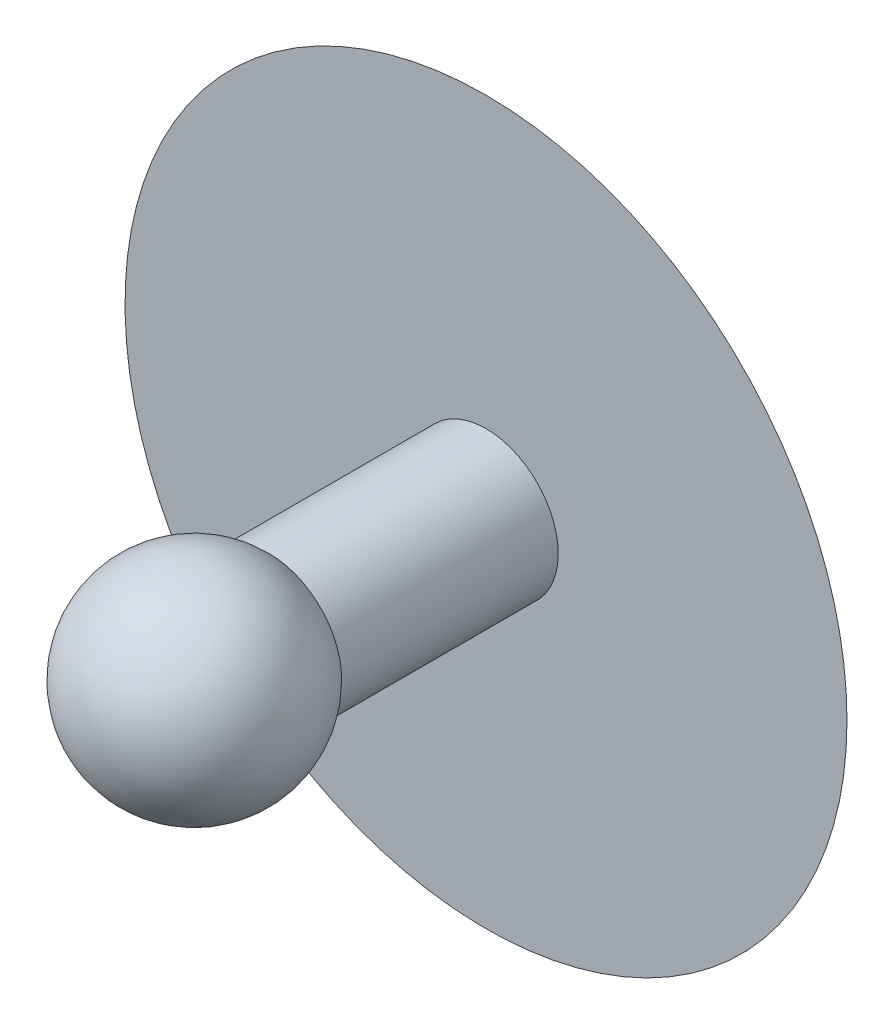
SolidWorks part; units mm, degrees
ref_plane "Plan de face" through (0, 0, 0) normal (0, 0, 1) x (1, 0, 0)
ref_plane "Plan de dessus" through (0, 0, 0) normal (0, 1, 0) x (1, 0, 0)
ref_plane "Plan de droite" through (0, 0, 0) normal (1, 0, 0) x (0, 0, -1)
sketch "Esquisse1" plane through (0, 0, 0) normal (1, 0, 0) x (0, 0, -1)
  line L0 (-1.5, 0) -> (-1.5, 0.5) construction
  line L1 (-1.5, 0.5) -> (0, 0.5)
  line L2 (0, 0.5) -> (0, 2.5)
  line L3 (-3.6754, 0) -> (3.3183, 0) construction
  line L4 (-1.5, 0) -> (0.15, 0)
  line L5 (-2.7422, 0) -> (-1.5, 0)
  arc A0 (0, 2.5) -> (0.15, 0) centre (-20.7583, 0) cw
  arc A1 (-1.5, 0.5) -> (-2.7422, 0) centre (-2.0205, 0) ccw
  dimension "D1" = 1.5
  dimension "D2" = 0.5
  dimension "D3" = 0
  dimension "D4" = 2
  dimension "D5" = 0.15
revolve "Révolution1" add sketch "Esquisse1" angle 360 about L3
